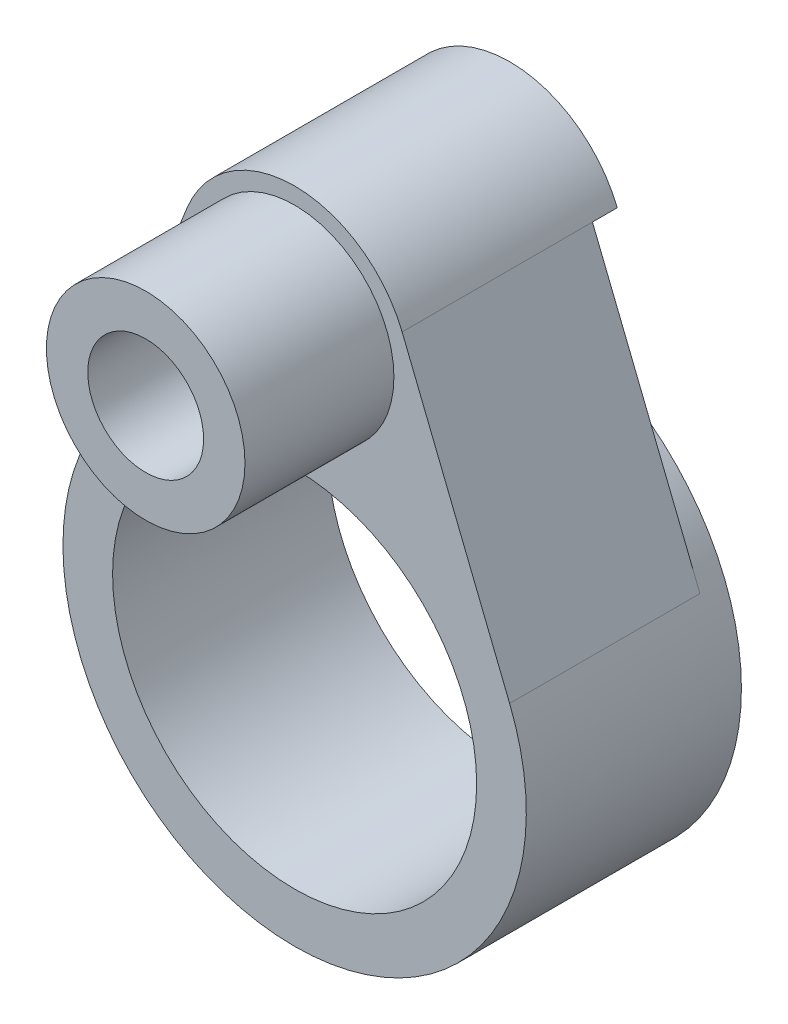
SolidWorks part; units mm, degrees
ref_plane "Plan1" through (0, 0, 0) normal (0, 0, 1) x (1, 0, 0)
ref_plane "Plan2" through (0, 0, 0) normal (0, 1, 0) x (1, 0, 0)
ref_plane "Plan3" through (0, 0, 0) normal (1, 0, 0) x (0, 0, -1)
sketch "Esquisse1" plane through (0, 0, 0) normal (0, 0, 1) x (1, 0, 0)
  line L0 (-12.9933, 5.2128) -> (-6.4967, 21.4064)
  line L1 (12.9933, 5.2128) -> (6.4967, 21.4064)
  arc A0 (-12.9933, 5.2128) -> (12.9933, 5.2128) centre (0, 0) ccw
  arc A1 (6.4967, 21.4064) -> (-6.4967, 21.4064) centre (0, 18.8) ccw
  circle A2 centre (0, 0) radius 11
  circle A3 centre (0, 18.8) radius 3.5
  dimension "D1" = 3
  dimension "D2" = 3.5
  dimension "D4" = 7
  dimension "D5" = 22
  dimension "D3" = 18.8
extrude "Base-Extrusion" add sketch "Esquisse1" along normal blind 13
sketch "Esquisse2" plane through (0, 0, 13) normal (0, 0, 1) x (1, 0, 0)
  circle A0 centre (0, 18.8) radius 3.5 construction
  circle A1 centre (0, 18.8) radius 3.5
  circle A2 centre (0, 18.8) radius 6
  dimension "D1" = 2.5
extrude "Boss.-Extru.1" add sketch "Esquisse2" along normal blind 9
sketch "Esquisse3" plane through (0, 0, 0) normal (0, 0, -1) x (-1, 0, 0)
  line L0 (6.4967, 21.4064) -> (12.9933, 5.2128) construction
  line L1 (-12.9933, 5.2128) -> (-6.4967, 21.4064) construction
  line L2 (6.4967, 21.4064) -> (12.9933, 5.2128)
  line L3 (-12.9933, 5.2128) -> (-6.4967, 21.4064)
  line L4 (-6.4967, 21.4064) -> (6.4967, 21.4064)
  arc A0 (12.9933, 5.2128) -> (-12.9933, 5.2128) centre (0, 0) ccw
  arc A1 (-12.9933, 5.2128) -> (12.9933, 5.2128) centre (0, 0) ccw construction
extrude "Enlèv. mat.-Extru.1" cut sketch "Esquisse3" against normal blind 1.5
